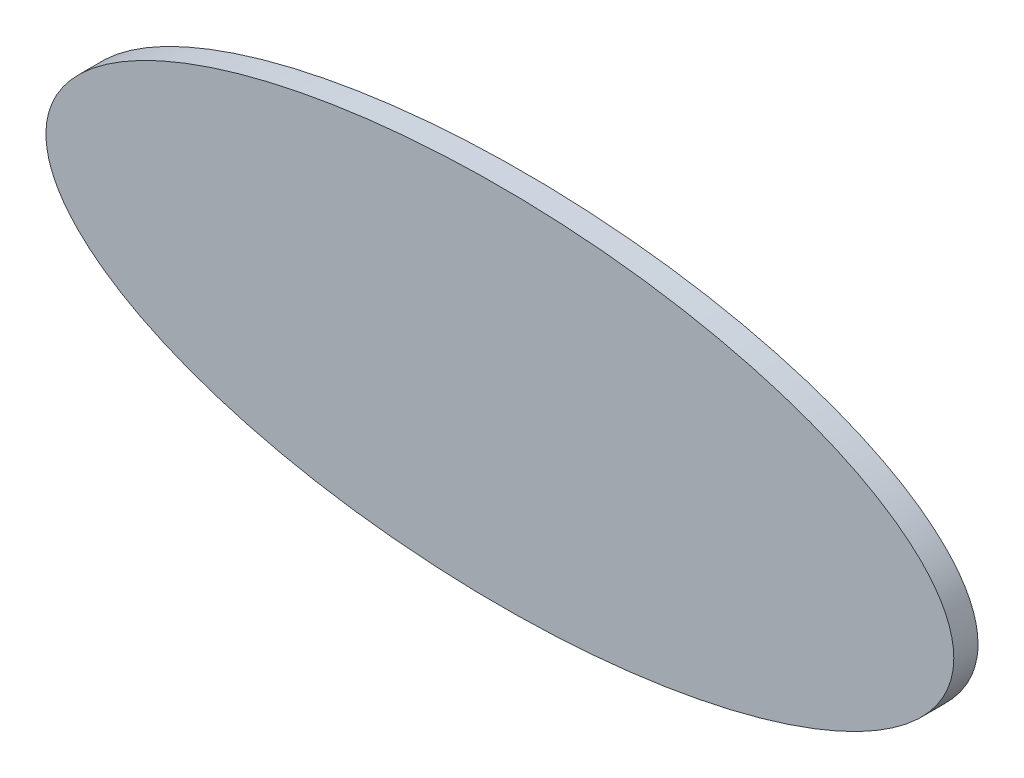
SolidWorks part; units mm, degrees
ref_plane "Front" through (0, 0, 0) normal (0, 0, 1) x (1, 0, 0)
ref_plane "Top" through (0, 0, 0) normal (0, 1, 0) x (1, 0, 0)
ref_plane "Right" through (0, 0, 0) normal (1, 0, 0) x (0, 0, -1)
sketch "Sketch1" plane through (0, 0, 0) normal (0, 0, 1) x (1, 0, 0)
  ellipse E0 centre (0, 0) end of major axis (37.5, 0) minor radius 15
  dimension "D1" = 15
  dimension "D2" = 75
extrude "Extrude1" add sketch "Sketch1" along normal blind 2
sketch "Sketch2" plane through (0, 0, 2) normal (0, 0, 1) x (1, 0, 0)
  ellipse E0 centre (0, 0) end of major axis (37.5, 0) minor radius 15 construction
  ellipse E1 centre (0, 0) end of major axis (-37.5, 0) minor radius 15 (0, -15) -> (0, 15) ccw
